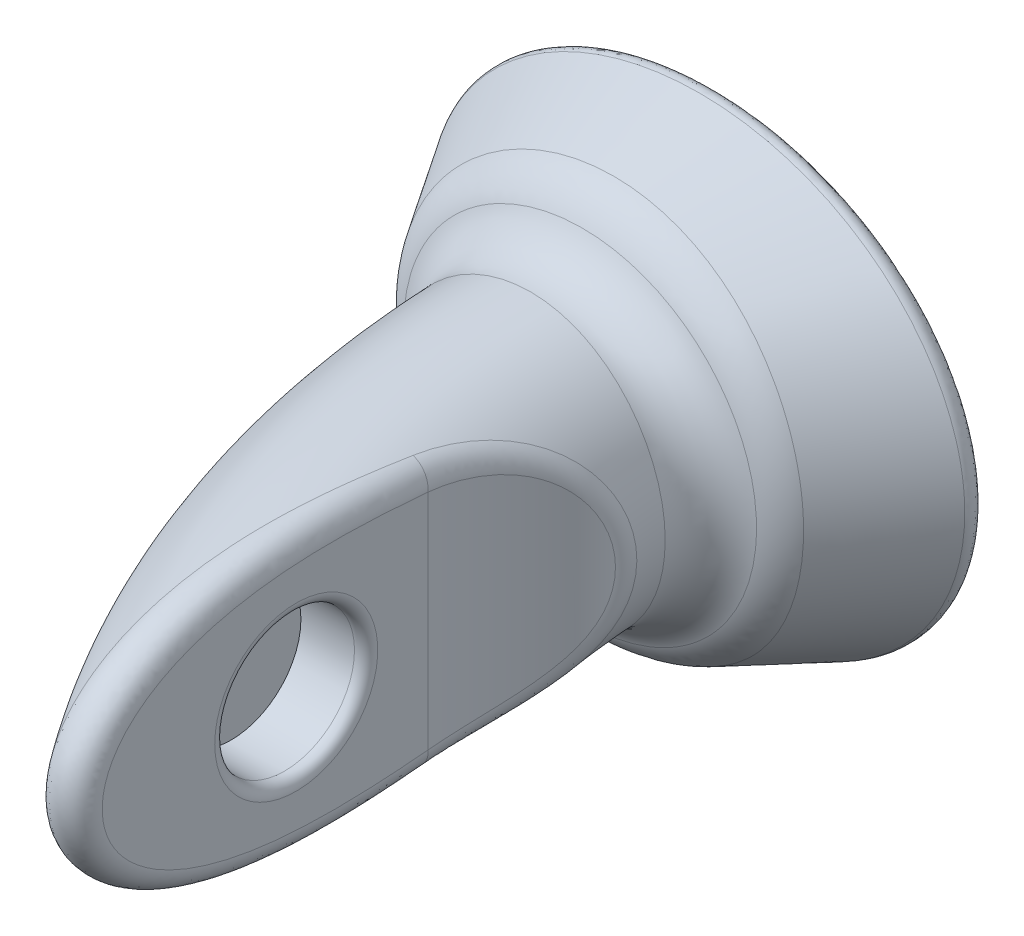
SolidWorks part; units mm, degrees
ref_plane "Front Plane" through (0, 0, 0) normal (0, 0, 1) x (1, 0, 0)
ref_plane " " through (0, 0, 0) normal (0, 1, 0) x (1, 0, 0)
ref_plane "Right Plane" through (0, 0, 0) normal (1, 0, 0) x (0, 0, -1)
sketch "Sketch1" plane through (0, 0, 0) normal (0, 0, 1) x (1, 0, 0)
  circle A0 centre (0, 0) radius 19.05
  dimension "D1" = 38.1
sketch "Sketch2" plane through (0, 0, 0) normal (0, 1, 0) x (1, 0, 0)
  line L0 (0, 0) -> (0, -60.29) construction
  arc A0 (0, 0) -> (29.1058, -76.2) centre (114.3, 0) ccw
  dimension "D1" = 114.3
  dimension "D2" = 76.2
sweep "Sweep1" add profiles "Sketch1" path "Sketch2"
sketch "Sketch3" plane through (0, 0, 0) normal (0, 1, 0) x (1, 0, 0)
  line L0 (12.7, -86.3693) -> (12.7, -32.8341)
  arc A0 (12.7, -32.8341) -> (19.9005, -12.7) centre (44.45, -32.8341) cw
  arc A1 (19.05, 0) -> (43.3048, -63.5) centre (114.3, 0) ccw construction
  arc A2 (-19.05, 0) -> (14.9068, -88.9) centre (114.3, 0) ccw construction
  dimension "D3" = 31.75
  dimension "D1" = 12.7
  dimension "D2" = 12.7
extrude "Face Cut" cut sketch "Sketch3" against normal through all and the other way through all flip side to cut
ref_plane "Plane1" through (0, 0, -19.05) normal (0, 0, -1) x (-1, 0, 0)
sketch "Sketch4" plane through (0, 0, -19.05) normal (0, 0, -1) x (-1, 0, 0)
  line L0 (38.1, 0) -> (0, 0) construction
  line L1 (0, 31.75) -> (0, 0) construction
  ellipse E0 centre (0, 0) end of major axis (38.1, 0) minor radius 31.75
  dimension "D1" = 31.75
  dimension "D2" = 38.1
sketch "Sketch5" plane through (0, 0, 0) normal (0, 0, -1) x (-1, 0, 0)
  circle A0 centre (0, 0) radius 25.4
  dimension "D1" = 50.8
loft "Loft1" add profiles "Sketch4", "Sketch5"
sketch "Sketch6" plane through (12.7, 0, 0) normal (1, 0, 0) x (0, 0, -1)
  line L0 (0, 0) -> (-94.9239, 0) construction
  line L1 (19.05, -31.75) -> (19.05, 31.75) construction
  circle A0 centre (-50.8, 0) radius 9.525
  point P5 (19.05, 0)
  dimension "D1" = 19.05
  dimension "D2" = 69.85
extrude "Mounting Hole" cut sketch "Sketch6" against normal blind 8.89
fillet "Base Fillet" radius 7.62 1 edges at (-25.4, 0, 0)
fillet "Transition Fillet" radius 7.62 2 edges at (19.05, 0, 0) (21.3151, -0.0022, 0)
fillet "Face Fillet" radius 3.175 2 edges at (19.8348, -1.6974, 12.7803) (12.7, 4.382, -85.5785)
fillet "Cosmetic Fillets" radius 1.5875 2 edges at (-38.1, 0, -19.05) (12.7, 0, 41.275)
